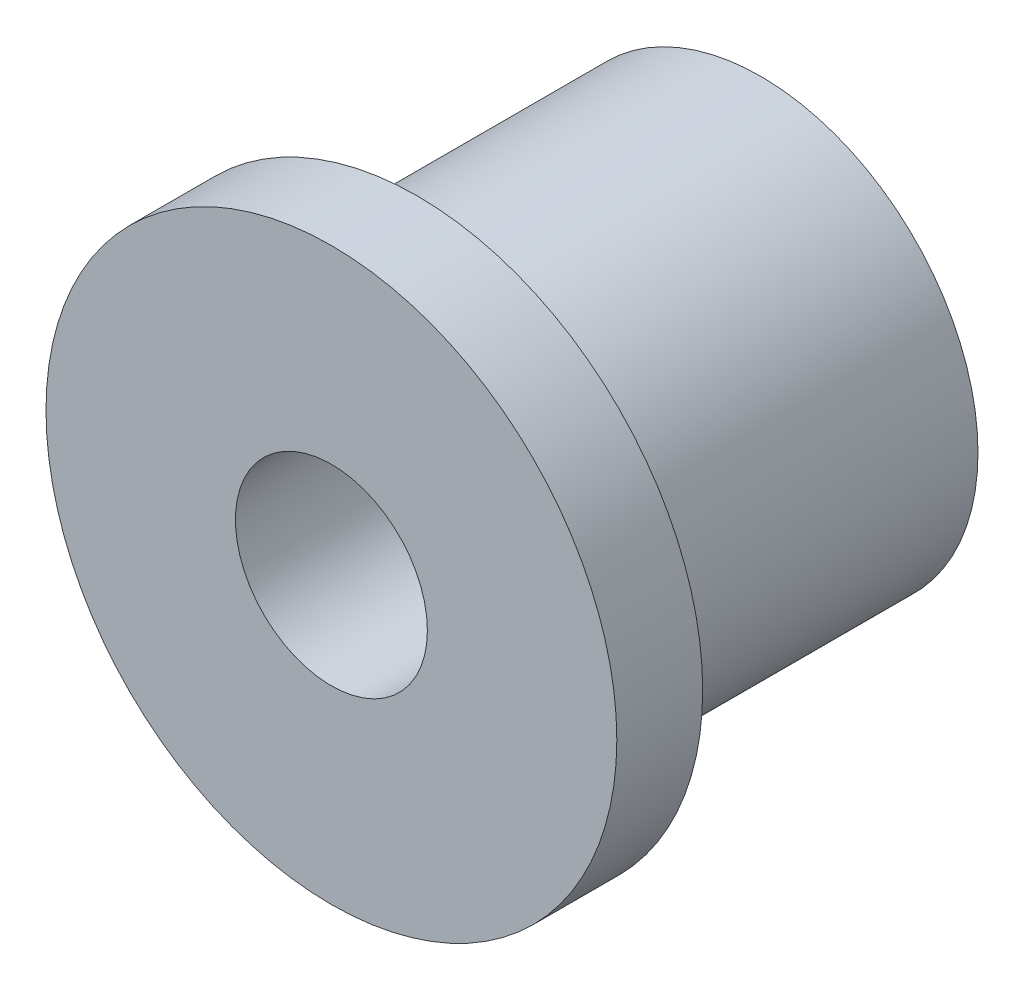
SolidWorks part; units mm, degrees
ref_plane "Plane1" through (0, 0, 0) normal (0, 0, 1) x (1, 0, 0)
ref_plane "Plane2" through (0, 0, 0) normal (0, 1, 0) x (1, 0, 0)
ref_plane "Plane3" through (0, 0, 0) normal (1, 0, 0) x (0, 0, -1)
sketch "Sketch1" plane through (0, 0, 0) normal (0, 0, 1) x (1, 0, 0)
  circle A0 centre (0, 0) radius 5.461
  dimension "D1" = 10.922
extrude "Base-Extrude" add sketch "Sketch1" along normal blind 8.636
sketch "Sketch5" plane through (0, 0, 8.636) normal (0, 0, 1) x (1, 0, 0)
  circle A0 centre (0, 0) radius 7.1755
  dimension "D1" = 14.351
extrude "Boss-Extrude4" add sketch "Sketch5" along normal blind 2.159
sketch "Sketch6" plane through (0, 0, 10.795) normal (0, 0, 1) x (1, 0, 0)
  circle A0 centre (0, 0) radius 2.413
  dimension "D1" = 4.826
extrude "Cut-Extrude1" cut sketch "Sketch6" against normal blind 7.874
equation "\"D5@Sketch2\" = \"flat@Sketch2\" * .57735"
equation "\"D4@Sketch2\" = \"D5@Sketch2\""
equation "\"D1@Sketch2\" = \"flat@Sketch2\"/2"
equation "\"D2@Sketch2\" = \"D5@Sketch2\""
equation "\"D3@Sketch2\" = \"D2@Sketch2\"/2"
